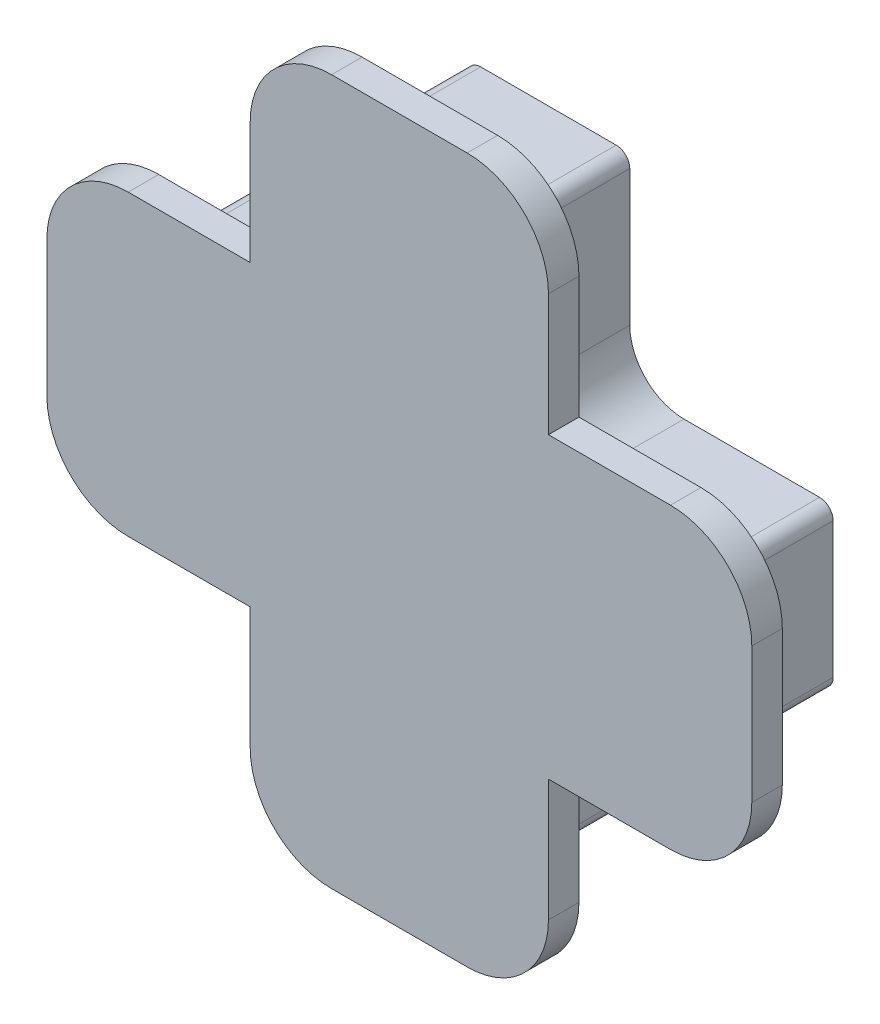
SolidWorks part; units mm, degrees
ref_plane "Front Plane" through (0, 0, 0) normal (0, 0, 1) x (1, 0, 0)
ref_plane "Top Plane" through (0, 0, 0) normal (0, 1, 0) x (1, 0, 0)
ref_plane "Right Plane" through (0, 0, 0) normal (1, 0, 0) x (0, 0, -1)
sketch "Sketch1" plane through (0, 0, 0) normal (0, 0, 1) x (1, 0, 0)
  line L25 (29.225, -20.447) -> (24.145, -20.447)
  line L26 (32.273, -28.067) -> (32.273, -23.495)
  line L27 (36.845, -28.067) -> (32.273, -28.067)
  line L28 (39.893, -36.195) -> (39.893, -31.115)
  line L29 (32.273, -39.243) -> (36.845, -39.243)
  line L30 (32.273, -43.815) -> (32.273, -39.243)
  line L31 (24.145, -46.863) -> (29.225, -46.863)
  line L32 (21.097, -39.243) -> (21.097, -43.815)
  line L33 (16.525, -39.243) -> (21.097, -39.243)
  line L34 (13.477, -31.115) -> (13.477, -36.195)
  line L35 (21.097, -28.067) -> (16.525, -28.067)
  line L36 (21.097, -23.495) -> (21.097, -28.067)
  line L37 (29.225, -20.447) -> (24.145, -20.447)
  line L38 (32.273, -28.067) -> (32.273, -23.495)
  line L39 (36.845, -28.067) -> (32.273, -28.067)
  line L40 (39.893, -36.195) -> (39.893, -31.115)
  line L41 (32.273, -39.243) -> (36.845, -39.243)
  line L42 (32.273, -43.815) -> (32.273, -39.243)
  line L43 (24.145, -46.863) -> (29.225, -46.863)
  line L44 (21.097, -39.243) -> (21.097, -43.815)
  line L45 (16.525, -39.243) -> (21.097, -39.243)
  line L46 (13.477, -31.115) -> (13.477, -36.195)
  line L47 (21.097, -28.067) -> (16.525, -28.067)
  line L48 (21.097, -23.495) -> (21.097, -28.067)
  arc A16 (24.145, -20.447) -> (21.097, -23.495) centre (24.145, -23.495) ccw
  arc A17 (32.273, -23.495) -> (29.225, -20.447) centre (29.225, -23.495) ccw
  arc A18 (39.893, -31.115) -> (36.845, -28.067) centre (36.845, -31.115) ccw
  arc A19 (36.845, -39.243) -> (39.893, -36.195) centre (36.845, -36.195) ccw
  arc A20 (29.225, -46.863) -> (32.273, -43.815) centre (29.225, -43.815) ccw
  arc A21 (21.097, -43.815) -> (24.145, -46.863) centre (24.145, -43.815) ccw
  arc A22 (13.477, -36.195) -> (16.525, -39.243) centre (16.525, -36.195) ccw
  arc A23 (16.525, -28.067) -> (13.477, -31.115) centre (16.525, -31.115) ccw
  arc A24 (24.145, -20.447) -> (21.097, -23.495) centre (24.145, -23.495) ccw
  arc A25 (32.273, -23.495) -> (29.225, -20.447) centre (29.225, -23.495) ccw
  arc A26 (39.893, -31.115) -> (36.845, -28.067) centre (36.845, -31.115) ccw
  arc A27 (36.845, -39.243) -> (39.893, -36.195) centre (36.845, -36.195) ccw
  arc A28 (29.225, -46.863) -> (32.273, -43.815) centre (29.225, -43.815) ccw
  arc A29 (21.097, -43.815) -> (24.145, -46.863) centre (24.145, -43.815) ccw
  arc A30 (13.477, -36.195) -> (16.525, -39.243) centre (16.525, -36.195) ccw
  arc A31 (16.525, -28.067) -> (13.477, -31.115) centre (16.525, -31.115) ccw
  dimension "D1" = 0.762
extrude "Boss-Extrude1" add sketch "Sketch1" against normal up to surface (1.905 mm away)
sketch "Sketch2" plane through (0, 0, -1.905) normal (0, 0, -1) x (-1, 0, 0)
  line L25 (-23.637, -28.575) -> (-23.637, -23.495)
  line L26 (-16.525, -30.607) -> (-21.605, -30.607)
  line L27 (-16.017, -36.195) -> (-16.017, -31.115)
  line L28 (-21.605, -36.703) -> (-16.525, -36.703)
  line L29 (-23.637, -43.815) -> (-23.637, -38.735)
  line L30 (-29.225, -44.323) -> (-24.145, -44.323)
  line L31 (-29.733, -38.735) -> (-29.733, -43.815)
  line L32 (-36.845, -36.703) -> (-31.765, -36.703)
  line L33 (-37.353, -31.115) -> (-37.353, -36.195)
  line L34 (-31.765, -30.607) -> (-36.845, -30.607)
  line L35 (-29.733, -23.495) -> (-29.733, -28.575)
  line L36 (-24.145, -22.987) -> (-29.225, -22.987)
  line L37 (-23.637, -28.575) -> (-23.637, -23.495)
  line L38 (-16.525, -30.607) -> (-21.605, -30.607)
  line L39 (-16.017, -36.195) -> (-16.017, -31.115)
  line L40 (-21.605, -36.703) -> (-16.525, -36.703)
  line L41 (-23.637, -43.815) -> (-23.637, -38.735)
  line L42 (-29.225, -44.323) -> (-24.145, -44.323)
  line L43 (-29.733, -38.735) -> (-29.733, -43.815)
  line L44 (-36.845, -36.703) -> (-31.765, -36.703)
  line L45 (-37.353, -31.115) -> (-37.353, -36.195)
  line L46 (-31.765, -30.607) -> (-36.845, -30.607)
  line L47 (-29.733, -23.495) -> (-29.733, -28.575)
  line L48 (-24.145, -22.987) -> (-29.225, -22.987)
  arc A24 (-23.637, -28.575) -> (-21.605, -30.607) centre (-21.605, -28.575) ccw
  arc A25 (-16.017, -31.115) -> (-16.525, -30.607) centre (-16.525, -31.115) ccw
  arc A26 (-16.525, -36.703) -> (-16.017, -36.195) centre (-16.525, -36.195) ccw
  arc A27 (-21.605, -36.703) -> (-23.637, -38.735) centre (-21.605, -38.735) ccw
  arc A28 (-24.145, -44.323) -> (-23.637, -43.815) centre (-24.145, -43.815) ccw
  arc A29 (-29.733, -43.815) -> (-29.225, -44.323) centre (-29.225, -43.815) ccw
  arc A30 (-29.733, -38.735) -> (-31.765, -36.703) centre (-31.765, -38.735) ccw
  arc A31 (-37.353, -36.195) -> (-36.845, -36.703) centre (-36.845, -36.195) ccw
  arc A32 (-36.845, -30.607) -> (-37.353, -31.115) centre (-36.845, -31.115) ccw
  arc A33 (-31.765, -30.607) -> (-29.733, -28.575) centre (-31.765, -28.575) ccw
  arc A34 (-29.225, -22.987) -> (-29.733, -23.495) centre (-29.225, -23.495) ccw
  arc A35 (-23.637, -23.495) -> (-24.145, -22.987) centre (-24.145, -23.495) ccw
  arc A36 (-23.637, -28.575) -> (-21.605, -30.607) centre (-21.605, -28.575) ccw
  arc A37 (-16.017, -31.115) -> (-16.525, -30.607) centre (-16.525, -31.115) ccw
  arc A38 (-16.525, -36.703) -> (-16.017, -36.195) centre (-16.525, -36.195) ccw
  arc A39 (-21.605, -36.703) -> (-23.637, -38.735) centre (-21.605, -38.735) ccw
  arc A40 (-24.145, -44.323) -> (-23.637, -43.815) centre (-24.145, -43.815) ccw
  arc A41 (-29.733, -43.815) -> (-29.225, -44.323) centre (-29.225, -43.815) ccw
  arc A42 (-29.733, -38.735) -> (-31.765, -36.703) centre (-31.765, -38.735) ccw
  arc A43 (-37.353, -36.195) -> (-36.845, -36.703) centre (-36.845, -36.195) ccw
  arc A44 (-36.845, -30.607) -> (-37.353, -31.115) centre (-36.845, -31.115) ccw
  arc A45 (-31.765, -30.607) -> (-29.733, -28.575) centre (-31.765, -28.575) ccw
  arc A46 (-29.225, -22.987) -> (-29.733, -23.495) centre (-29.225, -23.495) ccw
  arc A47 (-23.637, -23.495) -> (-24.145, -22.987) centre (-24.145, -23.495) ccw
  dimension "D1" = 0.762
extrude "Boss-Extrude2" add sketch "Sketch2" along normal blind 4.445
sketch "Sketch3" plane through (0, 0, 0) normal (0, 0, 1) x (1, 0, 0)
  circle A0 centre (26.685, -26.035) radius 2.54
  circle A1 centre (34.275, -33.655) radius 2.54
  circle A2 centre (26.685, -41.275) radius 2.54
  circle A3 centre (19.065, -33.655) radius 2.54
  dimension "D1" = 5.08
extrude "Cut-Extrude1" [suppressed] cut sketch "Sketch3" against normal blind 0.762
sketch "Sketch5" plane through (0, 0, 0) normal (1, 0, 0) x (0, 0, -1)
  line L1 (0, -20.447) -> (0.762, -20.447)
  line L2 (0, -20.447) -> (0, -46.863)
  line L3 (0, -46.863) -> (0.762, -46.863)
  line L4 (0.762, -20.447) -> (0.762, -46.863)
  line L5 (1.905, -46.863) -> (0, -46.863) construction
  dimension "D1" = 0.762
extrude "Cut-Extrude3" cut sketch "Sketch5" along normal through all
